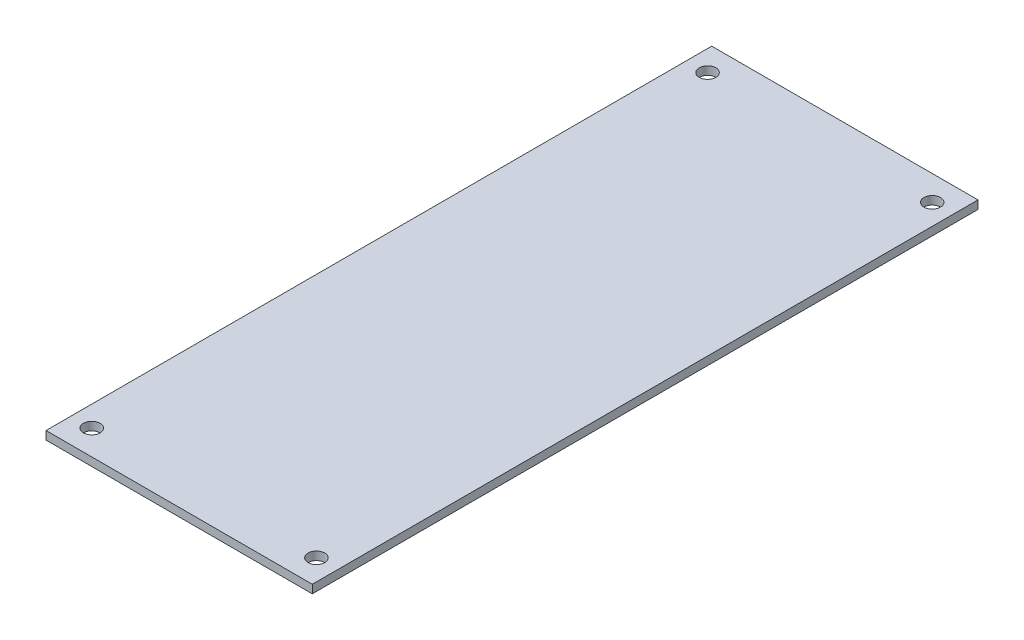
SolidWorks part; units mm, degrees
ref_plane "Front Plane" through (0, 0, 0) normal (0, 0, 1) x (1, 0, 0)
ref_plane "Top Plane" through (0, 0, 0) normal (0, 1, 0) x (1, 0, 0)
ref_plane "Right Plane" through (0, 0, 0) normal (1, 0, 0) x (0, 0, -1)
sketch "Sketch1" plane through (0, 0, 0) normal (0, 1, 0) x (1, 0, 0)
  line L1 (-25.4, 63.5) -> (25.4, 63.5)
  line L2 (-25.4, 63.5) -> (-25.4, -63.5)
  line L3 (-25.4, -63.5) -> (25.4, -63.5)
  line L4 (25.4, 63.5) -> (25.4, -63.5)
  line L5 (-25.4, 63.5) -> (25.4, -63.5) construction
  line L6 (-25.4, -63.5) -> (25.4, 63.5) construction
  point P0 (0, 0)
  dimension "D1" = 50.8
  dimension "D2" = 127
extrude "Boss-Extrude1" add sketch "Sketch1" along normal blind 1.5875
sketch "Sketch2" plane through (0, 0, 0) normal (0, 1, 0) x (1, 0, 0)
  circle A0 centre (-21.4312, 58.7375) radius 1.5875
  circle A1 centre (21.4313, 58.7375) radius 1.5875
  circle A2 centre (21.4313, -58.7375) radius 1.5875
  circle A3 centre (-21.4312, -58.7375) radius 1.5875
  dimension "D5" = 3.175
  dimension "D1" = 58.7375
  dimension "D2" = 58.7375
  dimension "D3" = 21.4312
  dimension "D4" = 21.4312
extrude "Cut-Extrude2" cut sketch "Sketch2" along normal through all
sketch "Sketch3" plane through (0, 0, 0) normal (0, -1, 0) x (1, 0, 0)
  line L6 (18.2562, -61.9125) -> (25.4, -61.9125)
  line L7 (18.2562, -55.5625) -> (18.2562, -61.9125)
  line L8 (25.4, -55.5625) -> (18.2562, -55.5625)
  line L9 (18.2562, 55.5625) -> (25.4, 55.5625)
  line L10 (18.2562, 61.9125) -> (18.2562, 55.5625)
  line L11 (25.4, 61.9125) -> (18.2562, 61.9125)
  line L12 (25.4, -61.9125) -> (25.4, -55.5625)
  line L13 (25.4, 55.5625) -> (25.4, 61.9125)
  line L14 (25.4, 63.5) -> (25.4, -63.5) construction
  line L15 (0, 0) -> (0, 54.1372) construction
  line L16 (-25.4, 55.5625) -> (-25.4, 61.9125)
  line L17 (-25.4, 61.9125) -> (-18.2562, 61.9125)
  line L18 (-18.2562, 61.9125) -> (-18.2562, 55.5625)
  line L19 (-18.2562, 55.5625) -> (-25.4, 55.5625)
  line L20 (-25.4, -61.9125) -> (-25.4, -55.5625)
  line L21 (-25.4, -55.5625) -> (-18.2562, -55.5625)
  line L22 (-18.2562, -55.5625) -> (-18.2562, -61.9125)
  line L23 (-18.2562, -61.9125) -> (-25.4, -61.9125)
  dimension "D1" = 6.35
  dimension "D2" = 6.35
  dimension "D3" = 55.5625
  dimension "D4" = 55.5625
  dimension "D5" = 18.2563
  dimension "D6" = 18.2562
